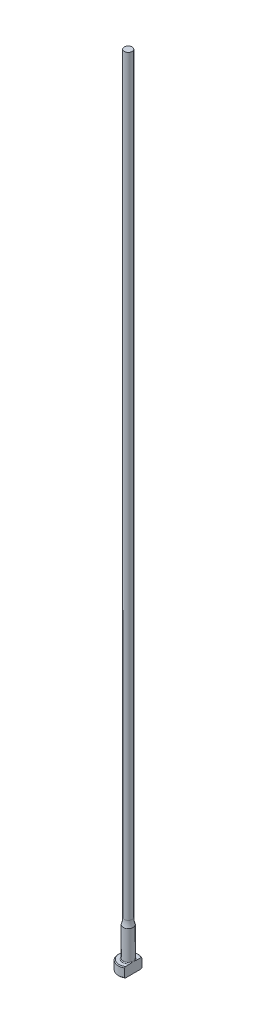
SolidWorks part; units mm, degrees
ref_plane "Front Plane" through (0, 0, 0) normal (0, 0, 1) x (1, 0, 0)
ref_plane "Top Plane" through (0, 0, 0) normal (0, 1, 0) x (1, 0, 0)
ref_plane "Right Plane" through (0, 0, 0) normal (1, 0, 0) x (0, 0, -1)
sketch "Sketch1" plane through (0, 0, 0) normal (0, 0, 1) x (1, 0, 0)
  line L0 (0, 259.9588) -> (0, -15.1925) construction
  line L1 (0, 0) -> (-3.175, 0)
  line L2 (-3.175, 0) -> (-3.175, 3.175)
  line L3 (-3.175, 3.175) -> (-1.5875, 3.175)
  line L4 (-1.2535, 14.7323) -> (-1.2535, 254)
  line L5 (-1.2535, 254) -> (0, 254)
  line L6 (0, 254) -> (0, 0)
  line L7 (-1.5875, 3.175) -> (-1.5875, 12.7)
  arc A0 (-1.5875, 12.7) -> (-1.2535, 14.7323) centre (-7.6035, 14.7323) ccw
  point P13 (-1.5875, 0)
  dimension "D1" = 6.35
  dimension "L" = 254
  dimension "D2" = 3.175
  dimension "H" = 6.35
  dimension "T" = 3.175
  dimension "D" = 2.507
  dimension "S" = 12.7
revolve "Revolve1" add sketch "Sketch1" angle 360 about L0
chamfer "Chamfer1" distance 0.254 angle 45 2 edges at (0, 3.175, 3.175) (0, 0, 3.175)
fillet "Fillet1" radius 0.254 1 edges at (0, 3.175, 1.5875)
sketch "Sketch2" plane through (0, 0, 0) normal (0, 1, 0) x (1, 0, 0)
  line L0 (1.5875, -2.7496) -> (1.5875, 2.7496)
  circle A0 centre (0, 0) radius 3.175 construction
  arc A2 (1.5875, -2.7496) -> (1.5875, 2.7496) centre (0, 0) ccw
  circle A3 centre (0, 0) radius 3.175 construction
  circle A4 centre (0, 0) radius 1.5875 construction
extrude "Key Head" cut sketch "Sketch2" along normal up to next
